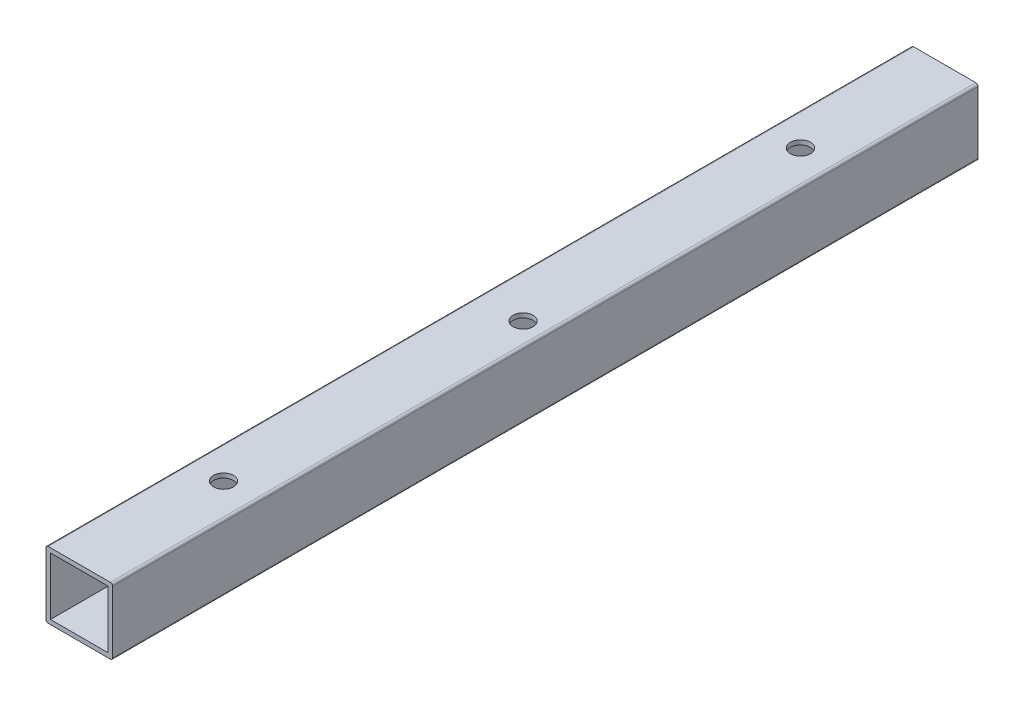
SolidWorks part; units mm, degrees
ref_plane "Plan1" through (0, 0, 0) normal (0, 0, 1) x (1, 0, 0)
ref_plane "Plan2" through (0, 0, 0) normal (0, 1, 0) x (1, 0, 0)
ref_plane "Plan3" through (0, 0, 0) normal (1, 0, 0) x (0, 0, -1)
sketch "Esquisse1" plane through (0, 0, 0) normal (0, 0, 1) x (1, 0, 0)
  line L0 (-14, 15) -> (14, 15)
  line L1 (-15, 14) -> (-15, -14)
  line L2 (14, -15) -> (-14, -15)
  line L3 (15, -14) -> (15, 14)
  line L4 (14, 14) -> (-14, -14) construction
  arc A0 (-14, -15) -> (-15, -14) centre (-14, -14) cw
  arc A1 (-15, 14) -> (-14, 15) centre (-14, 14) cw
  arc A2 (15, 14) -> (14, 15) centre (14, 14) ccw
  arc A3 (15, -14) -> (14, -15) centre (14, -14) cw
  dimension "D1" = 1
  dimension "D2" = 30
extrude "Base-Extru.-Mince" add sketch "Esquisse1" along normal blind 390 thin
sketch "Esquisse2" plane through (0, -15, 0) normal (0, -1, 0) x (1, 0, 0)
  line L0 (-15, 390) -> (-15, 0) construction
  circle A0 centre (0, 325) radius 4.5
  circle A1 centre (0, 65) radius 4.5
  circle A2 centre (5, 195) radius 4.5
  dimension "D1" = 9
  dimension "D4" = 130
  dimension "D2" = 260
  dimension "D3" = 65
  dimension "D5" = 20
extrude "Enlèv. mat.-Extru.1" cut sketch "Esquisse2" against normal blind 35
